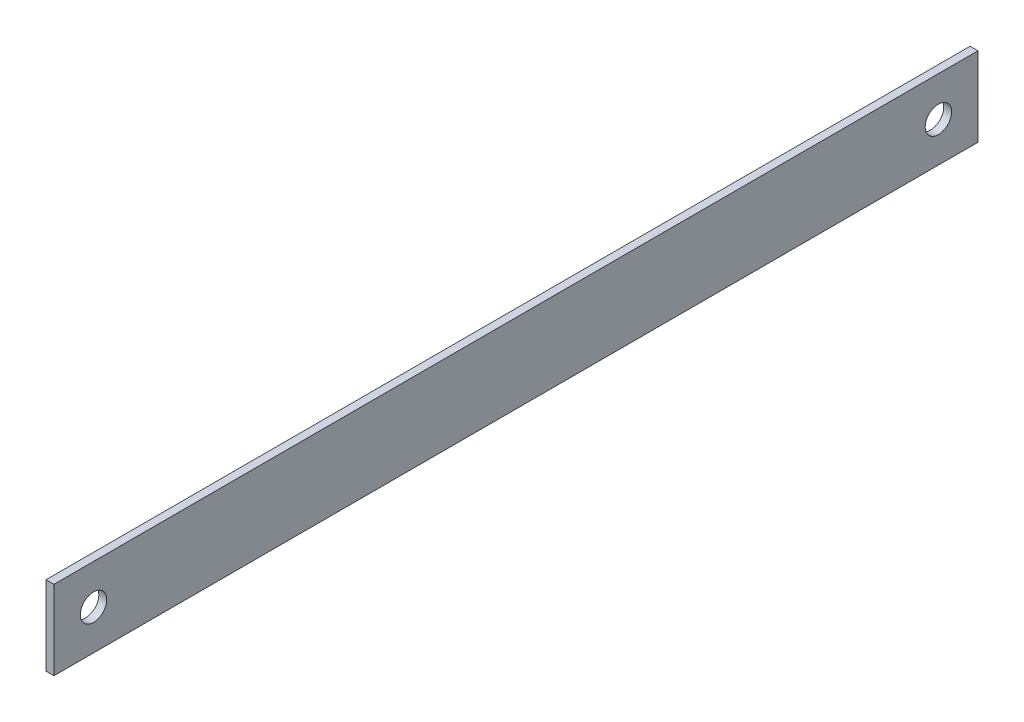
SolidWorks part; units mm, degrees
ref_plane "Front Plane" through (0, 0, 0) normal (0, 0, 1) x (1, 0, 0)
ref_plane "Top Plane" through (0, 0, 0) normal (0, 1, 0) x (1, 0, 0)
ref_plane "Right Plane" through (0, 0, 0) normal (1, 0, 0) x (0, 0, -1)
sketch "Sketch1" plane through (0, 0, 0) normal (1, 0, 0) x (0, 0, -1)
  line L1 (-175, 15) -> (175, 15)
  line L2 (-175, 15) -> (-175, -15)
  line L3 (-175, -15) -> (175, -15)
  line L4 (175, 15) -> (175, -15)
  line L5 (-175, 15) -> (175, -15) construction
  line L6 (-175, -15) -> (175, 15) construction
  point P0 (0, 0)
  dimension "D1" = 350
  dimension "D2" = 30
extrude "Boss-Extrude1" add sketch "Sketch1" along normal mid plane 3
sketch "Sketch2" plane through (1.5, 0, 0) normal (1, 0, 0) x (0, 0, -1)
  line L0 (-175, 0) -> (175, 0) construction
  line L1 (-175, 15) -> (-175, -15) construction
  line L2 (175, -15) -> (175, 15) construction
  circle A0 centre (-160, 0) radius 5
  circle A1 centre (160, 0) radius 5
  dimension "D1" = 10
  dimension "D2" = 10
  dimension "D3" = 15
  dimension "D4" = 15
extrude "Cut-Extrude2" cut sketch "Sketch2" against normal blind 5
